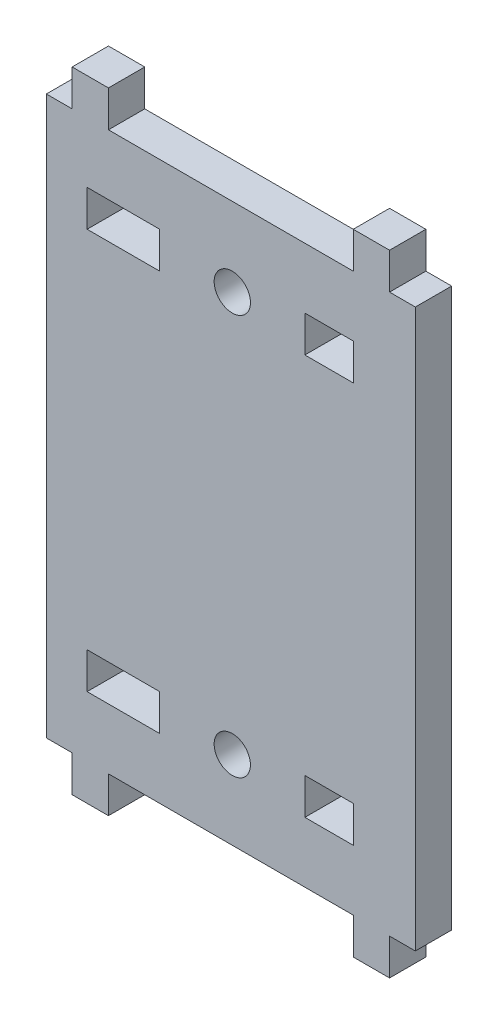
SolidWorks part; units mm, degrees
ref_plane "Front Plane" through (0, 0, 0) normal (0, 0, 1) x (1, 0, 0)
ref_plane "Top Plane" through (0, 0, 0) normal (0, 1, 0) x (1, 0, 0)
ref_plane "Right Plane" through (0, 0, 0) normal (1, 0, 0) x (0, 0, -1)
sketch "Sketch1" plane through (0, 0, 0) normal (0, 0, 1) x (1, 0, 0)
  line L42 (71.1887, 159.9411) -> (74.1887, 159.9411)
  line L52 (71.1887, 212.0411) -> (74.1887, 212.0411)
  line L53 (76.3206, 209.0411) -> (76.3206, 162.9411)
  line L54 (74.1887, 212.0411) -> (74.1887, 209.0411)
  line L55 (71.1887, 212.0411) -> (71.1887, 209.0411)
  line L59 (74.1887, 209.0411) -> (76.3206, 209.0411)
  line L67 (71.1887, 159.9411) -> (74.1887, 159.9411)
  line L68 (74.1887, 159.9411) -> (74.1887, 162.9411)
  line L69 (71.1887, 159.9411) -> (71.1887, 162.9411)
  line L73 (74.1887, 162.9411) -> (76.3206, 162.9411)
  line L77 (45.8206, 209.0411) -> (47.9525, 209.0411)
  line L78 (50.9525, 209.0411) -> (71.1887, 209.0411)
  line L79 (45.8206, 162.9411) -> (47.9525, 162.9411)
  line L80 (50.9525, 162.9411) -> (71.1887, 162.9411)
  line L93 (55.1887, 204.0411) -> (55.1887, 201.0411)
  line L94 (67.1887, 204.0411) -> (67.1887, 201.0411)
  line L95 (71.1887, 204.0411) -> (67.1887, 204.0411)
  line L96 (55.1887, 204.0411) -> (49.1887, 204.0411)
  line L97 (71.1887, 201.0411) -> (67.1887, 201.0411)
  line L98 (55.1887, 201.0411) -> (49.1887, 201.0411)
  line L99 (49.1887, 204.0411) -> (49.1887, 201.0411)
  line L100 (71.1887, 201.0411) -> (71.1887, 204.0411)
  line L101 (55.1887, 167.9411) -> (55.1887, 170.9411)
  line L102 (67.1887, 167.9411) -> (67.1887, 170.9411)
  line L103 (71.1887, 167.9411) -> (67.1887, 167.9411)
  line L104 (55.1887, 167.9411) -> (49.1887, 167.9411)
  line L105 (71.1887, 170.9411) -> (67.1887, 170.9411)
  line L106 (55.1887, 170.9411) -> (49.1887, 170.9411)
  line L107 (49.1887, 167.9411) -> (49.1887, 170.9411)
  line L108 (71.1887, 170.9411) -> (71.1887, 167.9411)
  line L109 (50.9525, 212.0411) -> (47.9525, 212.0411)
  line L110 (47.9525, 212.0411) -> (47.9525, 209.0411)
  line L111 (50.9525, 212.0411) -> (50.9525, 209.0411)
  line L112 (50.9525, 159.9411) -> (47.9525, 159.9411)
  line L113 (47.9525, 159.9411) -> (47.9525, 162.9411)
  line L114 (50.9525, 159.9411) -> (50.9525, 162.9411)
  line L441 (45.8206, 209.0411) -> (45.8206, 162.9411)
  circle A35 centre (61.1887, 202.5411) radius 1.5
  circle A37 centre (61.1887, 169.4411) radius 1.5
extrude "Boss-Extrude1" add sketch "Sketch1" along normal blind 3
